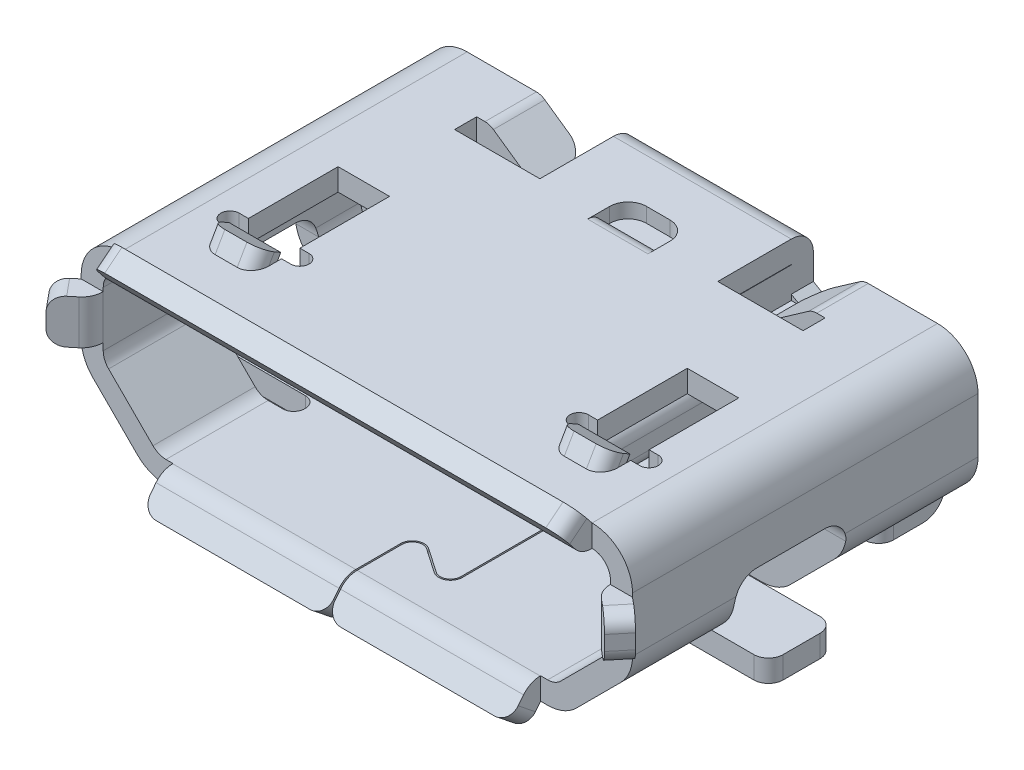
SolidWorks part; units mm, degrees
ref_plane "Front Plane" through (0, 0, 0) normal (0, 0, 1) x (1, 0, 0)
ref_plane "Top Plane" through (0, 0, 0) normal (0, 1, 0) x (1, 0, 0)
ref_plane "Right Plane" through (0, 0, 0) normal (1, 0, 0) x (0, 0, -1)
imported_body "Imported3"
sketch "Sketch1" plane through (0, 0, -2.35) normal (0, 0, -1) x (-1, 0, 0)
  line L0 (1.175, -1.255) -> (1.175, -1.105)
  line L1 (1.175, -1.105) -> (1.425, -1.105)
  line L2 (1.425, -1.105) -> (1.425, -1.255)
  line L3 (1.425, -1.255) -> (1.175, -1.255)
extrude "Boss-Extrude1" add sketch "Sketch1" along normal blind 0.3
sketch "Sketch2" plane through (0, 0, -2.35) normal (0, 0, -1) x (-1, 0, 0)
  line L0 (0.525, -1.255) -> (0.525, -1.105)
  line L1 (0.525, -1.105) -> (0.775, -1.105)
  line L2 (0.775, -1.105) -> (0.775, -1.255)
  line L3 (0.775, -1.255) -> (0.525, -1.255)
extrude "Boss-Extrude2" add sketch "Sketch2" along normal blind 0.3
sketch "Sketch3" plane through (0, 0, -2.35) normal (0, 0, -1) x (-1, 0, 0)
  line L0 (-0.125, -1.255) -> (-0.125, -1.105)
  line L1 (-0.125, -1.105) -> (0.125, -1.105)
  line L2 (0.125, -1.105) -> (0.125, -1.255)
  line L3 (0.125, -1.255) -> (-0.125, -1.255)
extrude "Boss-Extrude3" add sketch "Sketch3" along normal blind 0.3
sketch "Sketch4" plane through (0, 0, -2.35) normal (0, 0, -1) x (-1, 0, 0)
  line L0 (-0.775, -1.255) -> (-0.775, -1.105)
  line L1 (-0.775, -1.105) -> (-0.525, -1.105)
  line L2 (-0.525, -1.105) -> (-0.525, -1.255)
  line L3 (-0.525, -1.255) -> (-0.775, -1.255)
extrude "Boss-Extrude4" add sketch "Sketch4" along normal blind 0.3
sketch "Sketch5" plane through (0, 0, -2.35) normal (0, 0, -1) x (-1, 0, 0)
  line L0 (-1.425, -1.255) -> (-1.425, -1.105)
  line L1 (-1.425, -1.105) -> (-1.175, -1.105)
  line L2 (-1.175, -1.105) -> (-1.175, -1.255)
  line L3 (-1.175, -1.255) -> (-1.425, -1.255)
extrude "Boss-Extrude5" add sketch "Sketch5" along normal blind 0.3
sketch "Sketch6" plane through (0.185, 0, 0) normal (-1, 0, 0) x (0, 0, 1)
  line L0 (-1.15, 0.165) -> (-1.15, 0.265)
  line L1 (-1.15, 0.265) -> (1.15, 0.265)
  line L2 (1.05, 0.165) -> (-1.15, 0.165)
  arc A0 (1.15, 0.265) -> (1.05, 0.165) centre (1.05, 0.265) cw
extrude "Boss-Extrude6" add sketch "Sketch6" along normal blind 0.37
sketch "Sketch7" plane through (0.835, 0, 0) normal (-1, 0, 0) x (0, 0, 1)
  line L0 (-1.15, 0.165) -> (-1.15, 0.265)
  line L1 (-1.15, 0.265) -> (1.15, 0.265)
  line L2 (1.05, 0.165) -> (-1.15, 0.165)
  arc A0 (1.15, 0.265) -> (1.05, 0.165) centre (1.05, 0.265) cw
extrude "Boss-Extrude7" add sketch "Sketch7" along normal blind 0.37
sketch "Sketch8" plane through (-0.835, 0, 0) normal (1, 0, 0) x (0, 0, -1)
  line L0 (-1.15, 0.265) -> (1.15, 0.265)
  line L1 (1.15, 0.265) -> (1.15, 0.165)
  line L2 (1.15, 0.165) -> (-1.05, 0.165)
  arc A0 (-1.05, 0.165) -> (-1.15, 0.265) centre (-1.05, 0.265) cw
extrude "Boss-Extrude8" add sketch "Sketch8" along normal blind 0.37
sketch "Sketch9" plane through (1.485, 0, 0) normal (-1, 0, 0) x (0, 0, 1)
  line L0 (-1.15, 0.165) -> (-1.15, 0.265)
  line L1 (-1.15, 0.265) -> (1.15, 0.265)
  line L2 (1.05, 0.165) -> (-1.15, 0.165)
  arc A0 (1.15, 0.265) -> (1.05, 0.165) centre (1.05, 0.265) cw
extrude "Boss-Extrude9" add sketch "Sketch9" along normal blind 0.37
sketch "Sketch10" plane through (-1.485, 0, 0) normal (1, 0, 0) x (0, 0, -1)
  line L0 (-1.15, 0.265) -> (1.15, 0.265)
  line L1 (1.15, 0.265) -> (1.15, 0.165)
  line L2 (1.15, 0.165) -> (-1.05, 0.165)
  arc A0 (-1.05, 0.165) -> (-1.15, 0.265) centre (-1.05, 0.265) cw
extrude "Boss-Extrude10" add sketch "Sketch10" along normal blind 0.37
ref_plane "Plane1" through (1.5, 0, 0) normal (1, 0, 0) x (0, 0, -1)
sketch "Sketch11" plane through (1.5, 0, 0) normal (1, 0, 0) x (0, 0, -1)
  line L0 (0.65, -1.125) -> (0.2, -1.125)
  line L1 (0.2, -1.125) -> (0.2, -1.225)
  line L2 (0.2, -1.225) -> (0.65, -1.225)
  line L3 (0.65, -1.225) -> (0.65, -1.125)
extrude "Cut-Extrude1" cut sketch "Sketch11" against normal up to next
sketch "Sketch12" plane through (1.5, 0, 0) normal (1, 0, 0) x (0, 0, -1)
  line L0 (-1.55, -1.125) -> (-2, -1.125)
  line L1 (-2, -1.125) -> (-2, -1.225)
  line L2 (-2, -1.225) -> (-1.55, -1.225)
  line L3 (-1.55, -1.225) -> (-1.55, -1.125)
extrude "Cut-Extrude2" cut sketch "Sketch12" against normal up to next
ref_plane "Plane2" through (-0.35, 0, 0) normal (-1, 0, 0) x (0, -1, 0)
sketch "Sketch13" plane through (-0.35, 0, 0) normal (-1, 0, 0) x (0, -1, 0)
  line L0 (1.125, 2) -> (1.125, 1.55)
  line L1 (1.125, 1.55) -> (1.225, 1.55)
  line L2 (1.225, 1.55) -> (1.225, 2)
  line L3 (1.225, 2) -> (1.125, 2)
extrude "Cut-Extrude3" cut sketch "Sketch13" against normal up to next
sketch "Sketch14" plane through (-0.35, 0, 0) normal (-1, 0, 0) x (0, -1, 0)
  line L0 (1.125, -0.2) -> (1.125, -0.65)
  line L1 (1.125, -0.65) -> (1.225, -0.65)
  line L2 (1.225, -0.65) -> (1.225, -0.2)
  line L3 (1.225, -0.2) -> (1.125, -0.2)
extrude "Cut-Extrude4" cut sketch "Sketch14" against normal up to next
